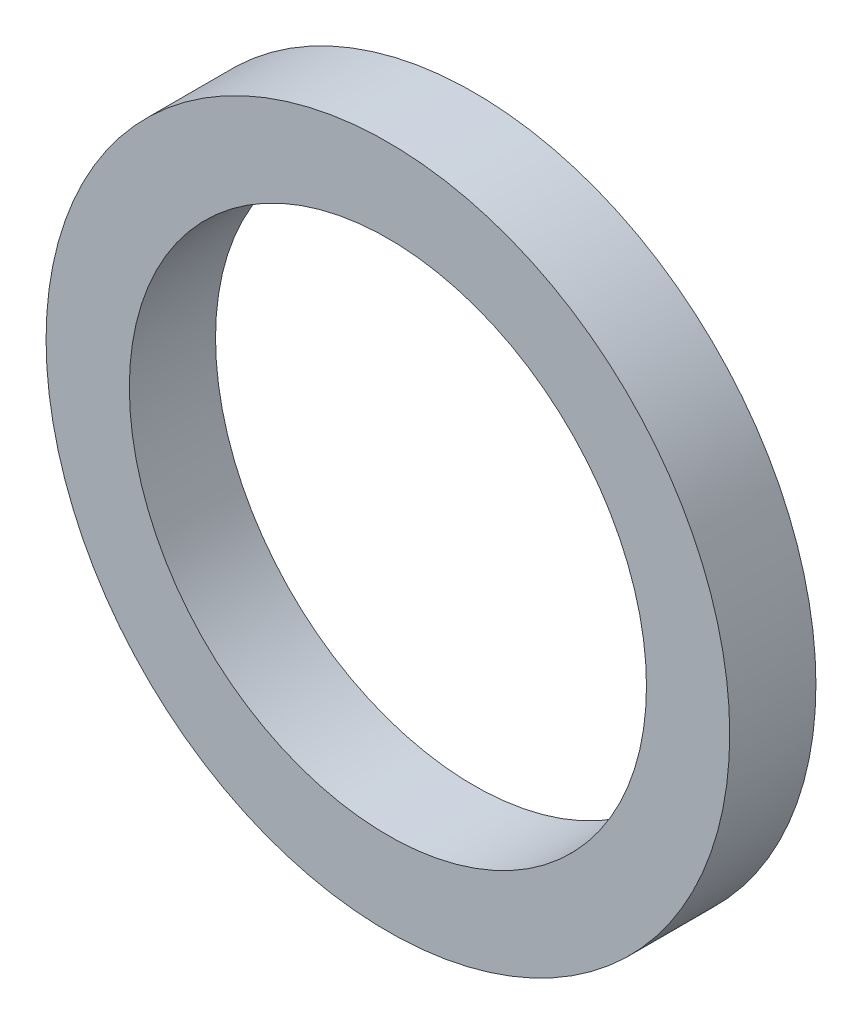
SolidWorks part; units mm, degrees
ref_plane "Front Plane" through (0, 0, 0) normal (0, 0, 1) x (1, 0, 0)
ref_plane "Top Plane" through (0, 0, 0) normal (0, 1, 0) x (1, 0, 0)
ref_plane "Right Plane" through (0, 0, 0) normal (1, 0, 0) x (0, 0, -1)
sketch "Sketch1" plane through (0, 0, 0) normal (0, 0, 1) x (1, 0, 0)
  circle A0 centre (0, 0) radius 25.1841
  circle A1 centre (0, 0) radius 19.05
  dimension "D1" = 38.1
  dimension "D2" = 50.3682
extrude "Boss-Extrude1" add sketch "Sketch1" along normal blind 6.35
